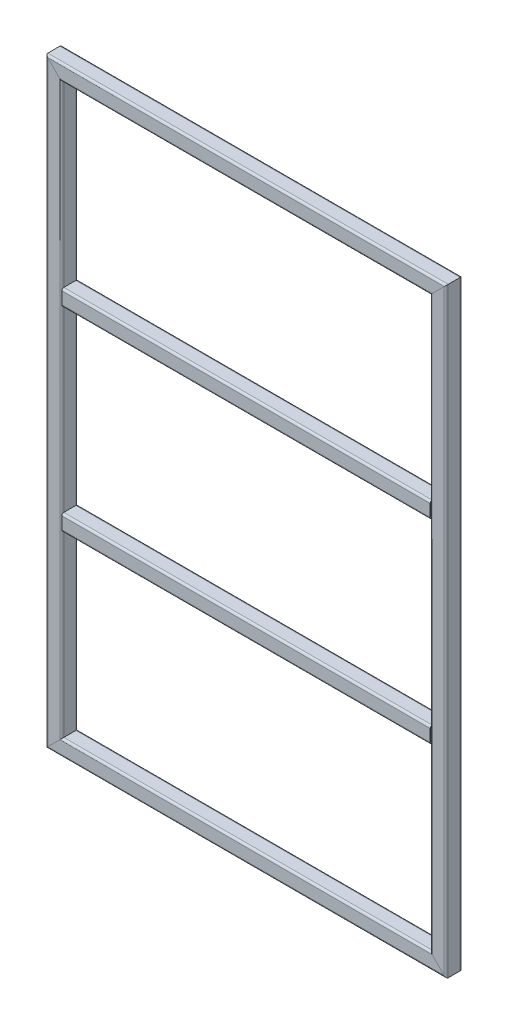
SolidWorks part; units mm, degrees
ref_plane "Płaszczyzna przednia" through (0, 0, 0) normal (0, 0, 1) x (1, 0, 0)
ref_plane "Płaszczyzna górna" through (0, 0, 0) normal (0, 1, 0) x (1, 0, 0)
ref_plane "Płaszczyzna prawa" through (0, 0, 0) normal (1, 0, 0) x (0, 0, -1)
sketch "Szkic1" plane through (0, 0, 0) normal (0, 0, 1) x (1, 0, 0)
  line L0 (960, 1460) -> (-960, 1460) construction
  line L1 (-960, -1460) -> (-960, 1460) construction
  line L2 (960, -1460) -> (-960, -1460) construction
  line L3 (960, -1460) -> (960, 1460) construction
  line L4 (960, 1460) -> (-960, 1460)
  line L5 (-960, -1460) -> (-960, 1460)
  line L6 (960, -1460) -> (-960, -1460)
  line L7 (960, -1460) -> (960, 1460)
  line L8 (-960, 486.6667) -> (960, 486.6667)
  line L9 (-960, -486.6667) -> (960, -486.6667)
  line L10 (0, 1460) -> (0, 486.6667) construction
  line L11 (0, 486.6667) -> (0, -486.6667) construction
  line L12 (0, -486.6667) -> (0, -1460) construction
other "Człon konstrukcyjny1"
ref_plane "Płaszczyzna1" through (-960, -1460, 0) normal (0, 1, 0) x (-1, 0, 0)
sketch "Sketch1" plane through (-960, -1460, 0) normal (0, 1, 0) x (-1, 0, 0)
  line L0 (-30, -35) -> (30, -35)
  line L1 (-35, -30) -> (-35, 30)
  line L2 (30, 35) -> (-30, 35)
  line L3 (35, 30) -> (35, -30)
  line L4 (-30, -40) -> (30, -40)
  line L5 (-40, -30) -> (-40, 30)
  line L6 (30, 40) -> (-30, 40)
  line L7 (40, 30) -> (40, -30)
  arc A0 (40, 30) -> (30, 40) centre (30, 30) ccw
  arc A1 (30, -40) -> (40, -30) centre (30, -30) ccw
  arc A2 (-40, -30) -> (-30, -40) centre (-30, -30) ccw
  arc A3 (-30, 40) -> (-40, 30) centre (-30, 30) ccw
  arc A4 (-30, 35) -> (-35, 30) centre (-30, 30) ccw
  arc A5 (35, 30) -> (30, 35) centre (30, 30) ccw
  arc A6 (30, -35) -> (35, -30) centre (30, -30) ccw
  arc A7 (-35, -30) -> (-30, -35) centre (-30, -30) ccw
  point P0 (-40, 0)
  point P1 (40, 0)
  point P2 (0, 40)
  point P3 (0, -40)
  point P4 (0, 0)
  point P5 (-40, -40)
  point P6 (40, -40)
  point P7 (40, 40)
  point P8 (-40, 40)
  point P33 (0, 0)
  dimension "D1" = 10
  dimension "Thickness" = 5
  dimension "V_leg" = 80
